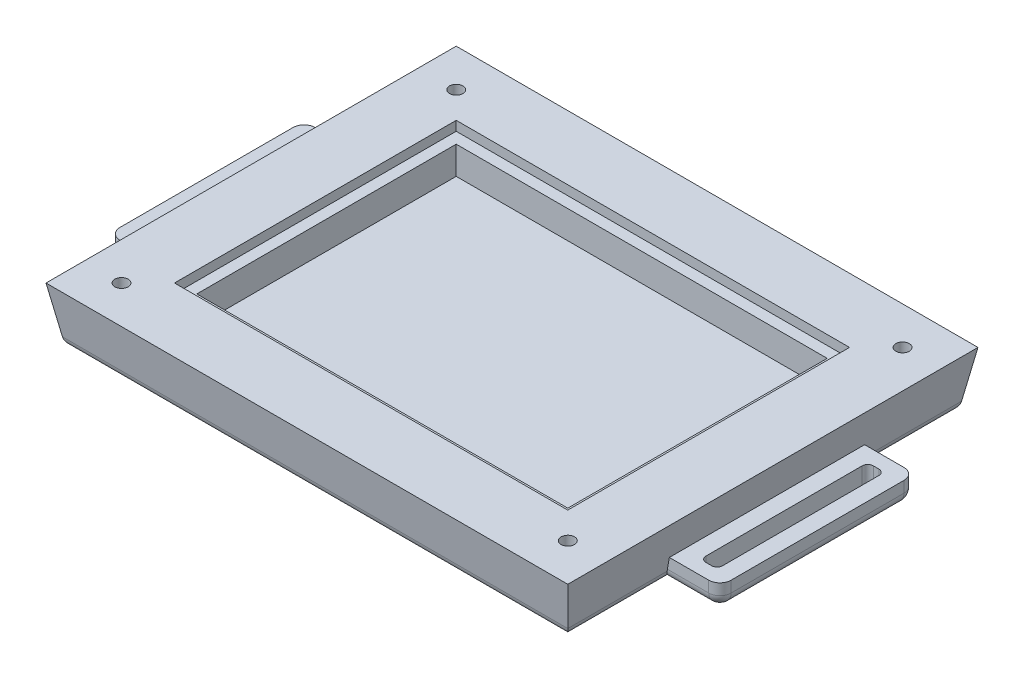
SolidWorks part; units mm, degrees
ref_plane "Front Plane" through (0, 0, 0) normal (0, 0, 1) x (1, 0, 0)
ref_plane "Top Plane" through (0, 0, 0) normal (0, 1, 0) x (1, 0, 0)
ref_plane "Right Plane" through (0, 0, 0) normal (1, 0, 0) x (0, 0, -1)
sketch "Sketch1" plane through (0, 0, 0) normal (0, 1, 0) x (1, 0, 0)
  line L0 (-45, 35) -> (45, 35)
  line L1 (-35, -25) -> (35, -25) construction
  line L2 (-35, -25) -> (-35, 25) construction
  line L3 (-35, 25) -> (35, 25) construction
  line L4 (35, -25) -> (35, 25) construction
  line L5 (-35, -25) -> (35, 25) construction
  line L6 (-35, 25) -> (35, -25) construction
  line L7 (45, -35) -> (45, 35)
  line L8 (-45, -35) -> (45, -35)
  line L9 (-45, -35) -> (-45, 35)
  point P0 (0, 0)
  dimension "D1" = 70
  dimension "D2" = 50
  dimension "D3" = 10
extrude "Boss-Extrude1" add sketch "Sketch1" along normal blind 10 draft 10
sketch "Sketch2" plane through (0, 10, 0) normal (0, 1, 0) x (1, 0, 0)
  line L1 (-35.25, -25.25) -> (35.25, -25.25)
  line L2 (-35.25, -25.25) -> (-35.25, 25.25)
  line L3 (-35.25, 25.25) -> (35.25, 25.25)
  line L4 (35.25, -25.25) -> (35.25, 25.25)
  line L5 (-35.25, -25.25) -> (35.25, 25.25) construction
  line L6 (-35.25, 25.25) -> (35.25, -25.25) construction
  point P0 (0, 0)
  dimension "D1" = 70.5
  dimension "D2" = 50.5
extrude "Cut-Extrude1" cut sketch "Sketch2" against normal blind 1.7
sketch "Sketch3" plane through (0, 8.3, 0) normal (0, 1, 0) x (1, 0, 0)
  line L0 (33.25, 23.25) -> (-33.25, 23.25)
  line L1 (-33.25, 23.25) -> (-33.25, -23.25)
  line L2 (-33.25, -23.25) -> (33.25, -23.25)
  line L3 (33.25, -23.25) -> (33.25, 23.25)
  line L4 (35.25, -25.25) -> (35.25, 25.25)
  line L5 (35.25, 25.25) -> (-35.25, 25.25)
  line L6 (-35.25, 25.25) -> (-35.25, -25.25)
  line L7 (-35.25, -25.25) -> (35.25, -25.25)
  line L8 (35.25, -25.25) -> (35.25, 25.25) construction
  line L9 (35.25, 25.25) -> (-35.25, 25.25) construction
  line L10 (-35.25, 25.25) -> (-35.25, -25.25) construction
  line L11 (-35.25, -25.25) -> (35.25, -25.25) construction
  dimension "D1" = 0
  dimension "D2" = 2
extrude "Cut-Extrude2" cut sketch "Sketch3" against normal blind 5
sketch "Sketch4" plane through (0, 10, 0) normal (0, 1, 0) x (1, 0, 0)
  line L1 (-40, -30) -> (40, -30) construction
  line L2 (-40, -30) -> (-40, 30) construction
  line L3 (-40, 30) -> (40, 30) construction
  line L4 (40, -30) -> (40, 30) construction
  line L5 (-40, -30) -> (40, 30) construction
  line L6 (-40, 30) -> (40, -30) construction
  point P0 (0, 0)
  dimension "D1" = 80
  dimension "D2" = 60
hole_wizard "M2 Clearance Hole1" positions "Sketch5" profile "Sketch6" hole size "M2" standard "ANSI Metric"
sketch "Sketch5" plane through (0, 10, 0) normal (0, 1, 0) x (1, 0, 0)
  point P0 (-40, 30)
  point P3 (-40, -30)
  point P6 (40, -30)
  point P9 (40, 30)
sketch "Sketch6" plane through (-40, 10, -30) normal (1, 0, 0) x (0, 0, 1)
  line L0 (0, 0) -> (0, 5.721)
  line L1 (0, 5.721) -> (1.2, 5)
  line L2 (1.2, 5) -> (1.2, 0)
  line L5 (1.2, 0) -> (0, 0)
  line L10 (0, 5.721) -> (-1.2, 5) construction
  line L11 (0, -6.35) -> (0, 107.95) construction
  dimension "Hole Dia." = 2.4
  dimension "Hole Depth" = 5
  dimension "Drill Angle" = 118
ref_plane "Plane1" through (46.7633, 0, 0) normal (1, 0, 0) x (0, 0, -1)
sketch "Sketch7" plane through (46.7633, 0, 0) normal (1, 0, 0) x (0, 0, -1)
  line L0 (-35, 0) -> (35, 0) construction
  line L1 (-17.5, 4) -> (17.5, 4)
  line L2 (-17.5, 4) -> (-17.5, 0)
  line L3 (-17.5, 0) -> (17.5, 0)
  line L4 (17.5, 4) -> (17.5, 0)
  line L5 (-17.5, 4) -> (17.5, 0) construction
  line L6 (-17.5, 0) -> (17.5, 4) construction
  point P0 (0, 2)
  point P7 (0, 0)
  dimension "D1" = 35
  dimension "D2" = 4
extrude "Boss-Extrude2" add sketch "Sketch7" along normal blind 8 and the other way up to next
sketch "Sketch8" plane through (0, 4, 0) normal (0, 1, 0) x (1, 0, 0)
  line L0 (54.7633, 17.5) -> (54.7633, -17.5) construction
  line L1 (49.7633, -15) -> (50.7633, -15)
  line L2 (48.7633, -14) -> (48.7633, 14)
  line L3 (49.7633, 15) -> (50.7633, 15)
  line L4 (51.7633, -14) -> (51.7633, 14)
  line L5 (48.7633, -15) -> (51.7633, 15) construction
  line L6 (48.7633, 15) -> (51.7633, -15) construction
  arc A0 (50.7633, -15) -> (51.7633, -14) centre (50.7633, -14) ccw
  arc A1 (49.7633, -15) -> (48.7633, -14) centre (49.7633, -14) cw
  arc A2 (48.7633, 14) -> (49.7633, 15) centre (49.7633, 14) cw
  arc A3 (50.7633, 15) -> (51.7633, 14) centre (50.7633, 14) cw
  point P0 (50.2633, 0)
  point P5 (0, 0)
  point P7 (50.7745, 0)
  dimension "D4" = 1
  dimension "D1" = 30
  dimension "D2" = 3
  dimension "D3" = 3
extrude "Cut-Extrude3" cut sketch "Sketch8" against normal through all
fillet "Fillet1" radius 2 2 edges at (54.7633, 2, -17.5) (54.7633, 2, 17.5)
mirror "Mirror1" about plane through (0, 0, 0) normal (1, 0, 0) of "Cut-Extrude3", "Fillet1", "Boss-Extrude2"
fillet "Fillet2" radius 2 16 edges at (48.8816, 0, -17.5) (54.1775, 0, -16.9142) (54.7633, 0, 0) (54.1775, 0, 16.9142) (-48.8816, 0, -17.5) (-54.1775, 0, -16.9142) (-54.7633, 0, 0) (-54.1775, 0, 16.9142) (48.8816, 0, 17.5) (45, 0, 26.25) (45, 0, -26.25) (0, 0, -35) (-45, 0, -26.25) (-48.8816, 0, 17.5) (-45, 0, 26.25) (0, 0, 35)
